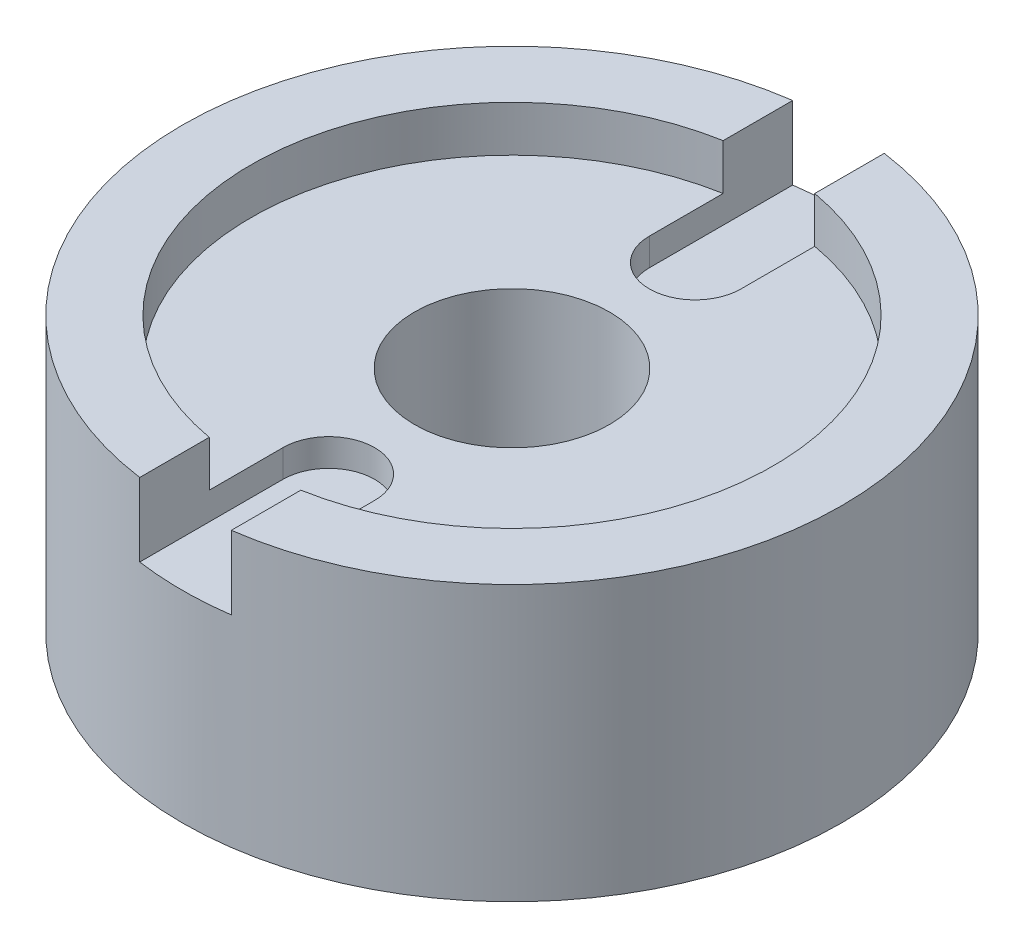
SolidWorks part; units mm, degrees
ref_plane "Front" through (0, 0, 0) normal (0, 0, 1) x (1, 0, 0)
ref_plane "Top" through (0, 0, 0) normal (0, 1, 0) x (1, 0, 0)
ref_plane "Right" through (0, 0, 0) normal (1, 0, 0) x (0, 0, -1)
sketch "Sketch1" plane through (0, 0, 0) normal (0, 1, 0) x (1, 0, 0)
  circle A0 centre (0, 0) radius 9.144
  dimension "D1" = 18.288
extrude "Extrude1" add sketch "Sketch1" along normal blind 7.62
sketch "Sketch2" plane through (0, 7.62, 0) normal (0, 1, 0) x (-1, 0, 0)
  circle A0 centre (0, 0) radius 7.239
  dimension "D1" = 14.478
extrude "Cut-Extrude1" cut sketch "Sketch2" against normal blind 1.27
hole_wizard "1/4-28 Tapped Hole1" positions "Sketch4" profile "Sketch3" tap size "1/4-28" standard "Ansi Inch"
sketch "Sketch4" plane through (0, 0, 0) normal (0, -1, 0) x (1, 0, 0)
  circle A0 centre (0, 0) radius 9.144 construction
  point P0 (0, 0)
sketch "Sketch3" plane through (0, 0, 0) normal (1, 0, 0) x (0, 0, -1)
  line L0 (0, 0) -> (0, 7.62)
  line L1 (0, 7.62) -> (2.7051, 7.62)
  line L2 (2.7051, 7.62) -> (2.7051, 0)
  line L5 (2.7051, 0) -> (0, 0)
  line L11 (0, -6.35) -> (0, 107.95) construction
  dimension "Thru Tap Drill Dia." = 5.4102
  dimension "Thru Tap Drill Depth" = 7.62
sketch "Sketch5" plane through (0, 7.62, 0) normal (0, 1, 0) x (-1, 0, 0)
  line L0 (-1.27, 5.08) -> (-1.27, 10.2769)
  line L1 (1.27, 5.08) -> (1.27, 10.2769)
  line L2 (1.27, 10.2769) -> (-1.27, 10.2769)
  arc A0 (-1.27, 5.08) -> (1.27, 5.08) centre (0, 5.08) ccw
  dimension "D1" = 2.54
  dimension "D2" = 5.08
extrude "Cut-Extrude2" cut sketch "Sketch5" against normal blind 2.032
mirror "Mirror1" about plane through (0, 0, 0) normal (0, 0, 1) of "Cut-Extrude2"
